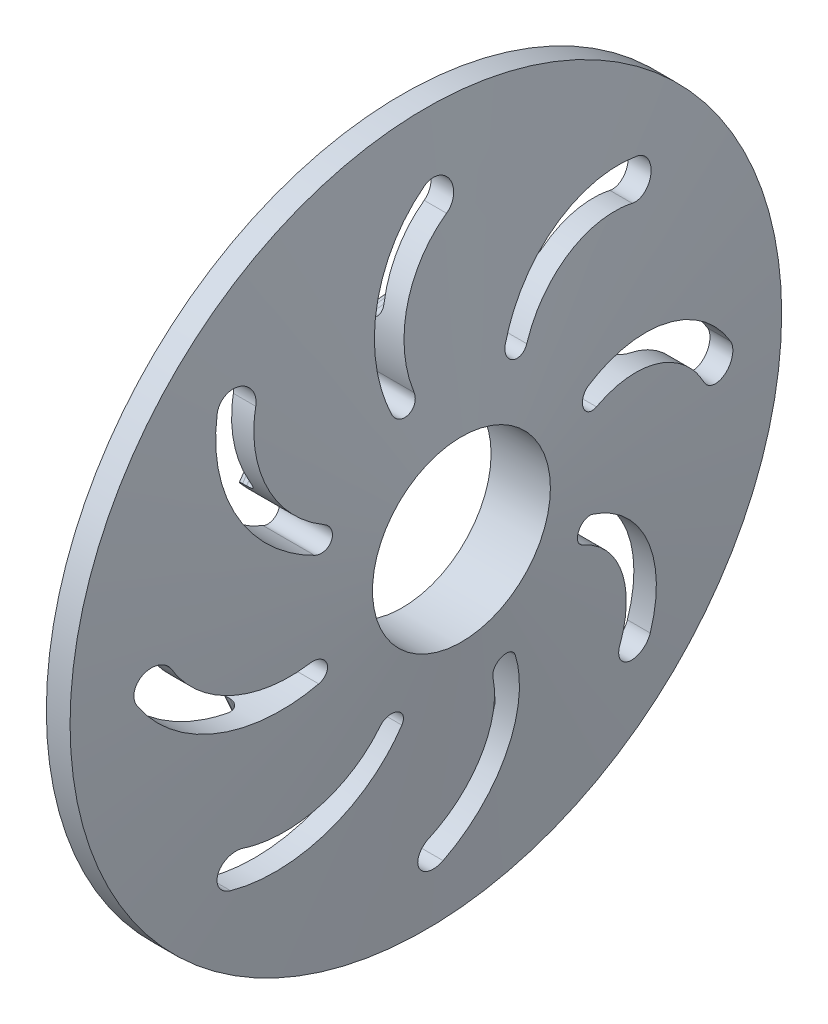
SolidWorks part; units mm, degrees
ref_plane "Front Plane" through (0, 0, 0) normal (0, 0, 1) x (1, 0, 0)
ref_plane "Top Plane" through (0, 0, 0) normal (0, 1, 0) x (1, 0, 0)
ref_plane "Right Plane" through (0, 0, 0) normal (1, 0, 0) x (0, 0, -1)
sketch "Sketch1" plane through (0, 0, 0) normal (1, 0, 0) x (0, 0, -1)
  circle A0 centre (0, 0) radius 76.2
  dimension "D1" = 152.4
extrude "Boss-Extrude1" add sketch "Sketch1" along normal blind 12.7
sketch "Sketch2" plane through (12.7, 0, 0) normal (1, 0, 0) x (0, 0, -1)
  circle A0 centre (0, 0) radius 19.05
  dimension "D1" = 38.1
extrude "Cut-Extrude1" cut sketch "Sketch2" against normal blind 12.7
sketch "Sketch4" plane through (0, 0, 0) normal (0, 0, 1) x (1, 0, 0)
  line L1 (12.7, 76.2) -> (12.7, 19.05)
  line L2 (5.08, 76.2) -> (12.7, 19.05)
  line L3 (12.7, 76.2) -> (0, 76.2) construction
  line L4 (12.7, 76.2) -> (5.08, 76.2)
  dimension "D1" = 5.08
  dimension "D2" = 57.15
revolve "Cut-Revolve1" cut sketch "Sketch4" angle 360 about axis through (12.7, 0, 0) along (-1, 0, 0)
sketch "Sketch5" plane through (0, 0, 0) normal (0, 0, 1) x (1, 0, 0)
  line L0 (0, 76.2) -> (5.08, 41.91)
  line L1 (5.08, 41.91) -> (0, 41.91)
  line L3 (0, 76.2) -> (0, -76.2) construction
  line L4 (0, 41.91) -> (0, 76.2)
  dimension "D1" = 34.29
  dimension "D2" = 5.08
revolve "Cut-Revolve2" cut sketch "Sketch5" angle 360 about axis through (0, 0, 0) along (1, 0, 0)
sketch "Sketch6" plane through (0, 0, 0) normal (-1, 0, 0) x (0, 0, 1)
  circle A0 centre (-35.921, 0) radius 2.54
  dimension "D1" = 5.08
  dimension "D2" = 35.921
extrude "Cut-Extrude2" cut sketch "Sketch6" against normal blind 6.35
pattern_circular "CirPattern1" count 4 over 360 about axis through (0, 0, 0) along (1, 0, 0) of "Cut-Extrude2"
fillet "Fillet1" radius 2.54 1 edges at (5.08, 0, 41.91)
fillet "Fillet2" radius 1.27 1 edges at (0, 0, 41.91)
sketch "Sketch7" plane through (0, 0, 0) normal (1, 0, 0) x (0, 0, -1)
  line L0 (0, 0) -> (-10.8591, 29.8352) construction
  line L1 (0, 0) -> (0, 60.325) construction
  circle A0 centre (0, 0) radius 31.75 construction
  circle A1 centre (0, 0) radius 60.325 construction
  arc A2 (-13.2093, 28.8717) -> (-2.0154, 63.5583) centre (12.9265, 39.5868) cw
  arc A3 (-8.4395, 30.6078) -> (1.8815, 57.012) centre (12.9909, 37.4502) cw
  arc A4 (-10.8591, 29.8352) -> (0, 60.325) centre (12.9959, 38.5178) cw construction
  arc A5 (1.8815, 57.012) -> (-2.0154, 63.5583) centre (0, 60.325) ccw
  arc A6 (-13.2093, 28.8717) -> (-8.4395, 30.6078) centre (-10.8591, 29.8352) ccw
  point P8 (15.2024, 80.0905)
  dimension "D1" = 63.5
  dimension "D2" = 120.65
  dimension "D3" = 20
  dimension "D4" = 3.81
  dimension "D5" = 2.54
extrude "Cut-Extrude3" cut sketch "Sketch7" along normal through all
pattern_circular "CirPattern3" count 8 over 360 about axis through (0, 0, 0) along (1, 0, 0) of "Cut-Extrude3"
